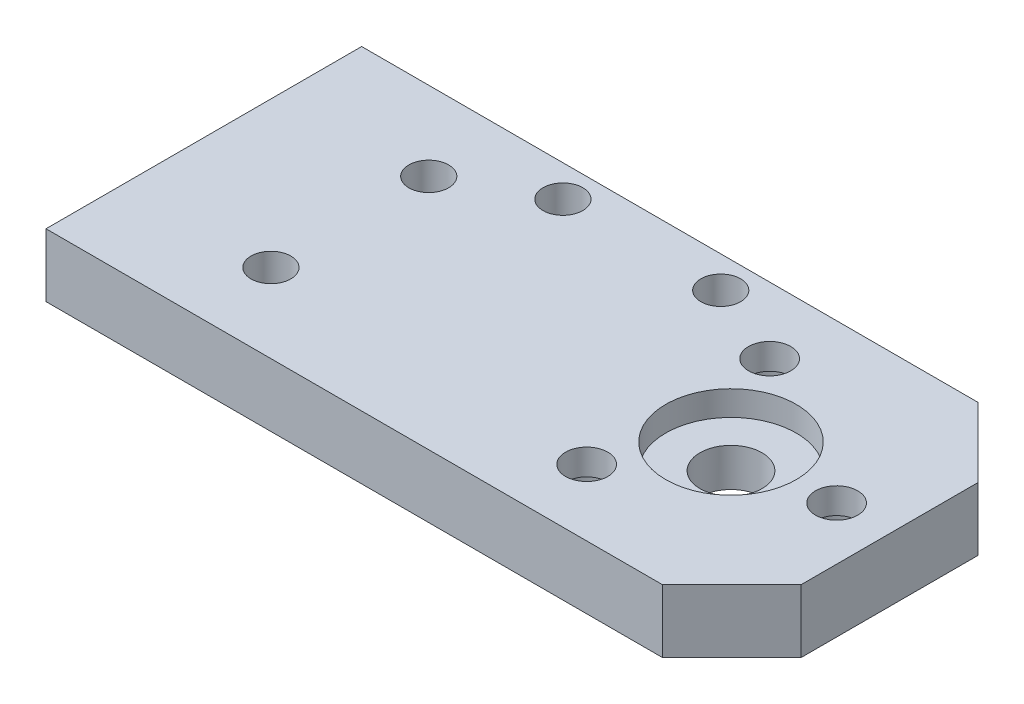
SolidWorks part; units mm, degrees
ref_plane "Front Plane" through (0, 0, 0) normal (0, 0, 1) x (1, 0, 0)
ref_plane "Top Plane" through (0, 0, 0) normal (0, 1, 0) x (1, 0, 0)
ref_plane "Right Plane" through (0, 0, 0) normal (1, 0, 0) x (0, 0, -1)
sketch "Sketch1" plane through (0, 0, 0) normal (0, 1, 0) x (1, 0, 0)
  line L1 (0, 0) -> (55.1815, 0)
  line L2 (0, 0) -> (0, 25.4)
  line L3 (0, 25.4) -> (55.1815, 25.4)
  line L4 (55.1815, 0) -> (55.1815, 25.4)
  dimension "D1" = 25.4
  dimension "D2" = 55.1815
extrude "Boss-Extrude1" add sketch "Sketch1" along normal blind 5.08
sketch "Sketch2" plane through (0, 5.08, 0) normal (0, 1, 0) x (1, 0, 0)
  line L0 (42.4175, 0) -> (42.4175, 25.4) construction
  line L1 (0, 0) -> (55.1815, 0) construction
  line L2 (55.1815, 25.4) -> (0, 25.4) construction
  line L4 (0, 25.4) -> (0, 0) construction
  circle A0 centre (42.4175, 12.7) radius 2.5
  dimension "D1" = 5
  dimension "D2" = 42.4175
extrude "Cut-Extrude1" cut sketch "Sketch2" against normal blind 6
sketch "Sketch3" plane through (0, 5.08, 0) normal (0, 1, 0) x (1, 0, 0)
  circle A0 centre (42.4175, 12.7) radius 5.25
  dimension "D1" = 10.5
extrude "Cut-Extrude2" cut sketch "Sketch3" against normal blind 2
hole_wizard "CBORE for M3 SHCS2" positions "Sketch5" profile "Sketch4" counterbore size "M3" standard "ANSI Metric"
sketch "Sketch5" plane through (0, 0, 0) normal (0, -1, 0) x (-1, 0, 0)
  line L0 (-42.4175, 12.7) -> (-50.9175, 12.7) construction
  line L2 (-42.4175, 12.7) -> (-38.1675, 20.0612) construction
  line L4 (-42.4175, 12.7) -> (-38.1675, 5.3388) construction
  circle A0 centre (-42.4175, 12.7) radius 8.5 construction
  point P0 (-50.9175, 12.7)
  point P2 (-38.1675, 5.3388)
  point P4 (-38.1675, 20.0612)
  dimension "D1" = 17
  dimension "D2" = 120
  dimension "D3" = 120
sketch "Sketch4" plane through (50.9175, 0, -12.7) normal (1, 0, 0) x (0, 0, -1)
  line L0 (0, 0) -> (0, 7.0215)
  line L1 (0, 7.0215) -> (1.7, 6)
  line L2 (1.7, 6) -> (1.7, 3)
  line L3 (1.7, 3) -> (3.25, 3)
  line L4 (3.25, 3) -> (3.25, 0)
  line L5 (3.25, 0) -> (0, 0)
  line L10 (0, 7.0215) -> (-1.7, 6) construction
  line L11 (0, -6.35) -> (0, 107.95) construction
  dimension "Hole Dia." = 3.4
  dimension "Hole Depth" = 6
  dimension "C'Bore Dia." = 6.5
  dimension "C'Bore Depth" = 3
  dimension "Drill Angle" = 118
chamfer "Chamfer1" distance 5.588 angle 45 2 edges at (55.1815, 2.54, 0) (55.1815, 2.54, -25.4)
hole_wizard "M3 Clearance Hole1" positions "Sketch7" profile "Sketch6" hole size "M3" standard "ANSI Metric"
sketch "Sketch7" plane through (0, 5.08, 0) normal (0, 1, 0) x (1, 0, 0)
  line L0 (18.7325, 22.86) -> (31.4325, 22.86) construction
  line L2 (11.7475, 19.05) -> (11.7475, 6.35) construction
  line L4 (25.0825, 22.86) -> (25.0825, 25.4) construction
  line L5 (49.5935, 25.4) -> (0, 25.4) construction
  line L7 (11.7475, 12.7) -> (0, 12.7) construction
  line L8 (0, 25.4) -> (0, 0) construction
  line L10 (0, 0) -> (49.5935, 0) construction
  point P0 (31.4325, 22.86)
  point P2 (18.7325, 22.86)
  point P4 (11.7475, 19.05)
  point P6 (11.7475, 6.35)
  dimension "D1" = 12.7
  dimension "D2" = 12.7
  dimension "D3" = 18.7325
  dimension "D4" = 11.7475
  dimension "D5" = 2.54
  dimension "D6" = 12.7
sketch "Sketch6" plane through (31.4325, 5.08, -22.86) normal (1, 0, 0) x (0, 0, 1)
  line L0 (0, 0) -> (0, 8.26)
  line L1 (0, 8.26) -> (1.6, 8.26)
  line L2 (1.6, 8.26) -> (1.6, 0)
  line L5 (1.6, 0) -> (0, 0)
  line L10 (0, 8.26) -> (-1.6, 8.26) construction
  line L11 (0, -6.35) -> (0, 107.95) construction
  dimension "Hole Dia." = 3.2
  dimension "Hole Depth" = 8.26
  dimension "Drill Angle" = 180
